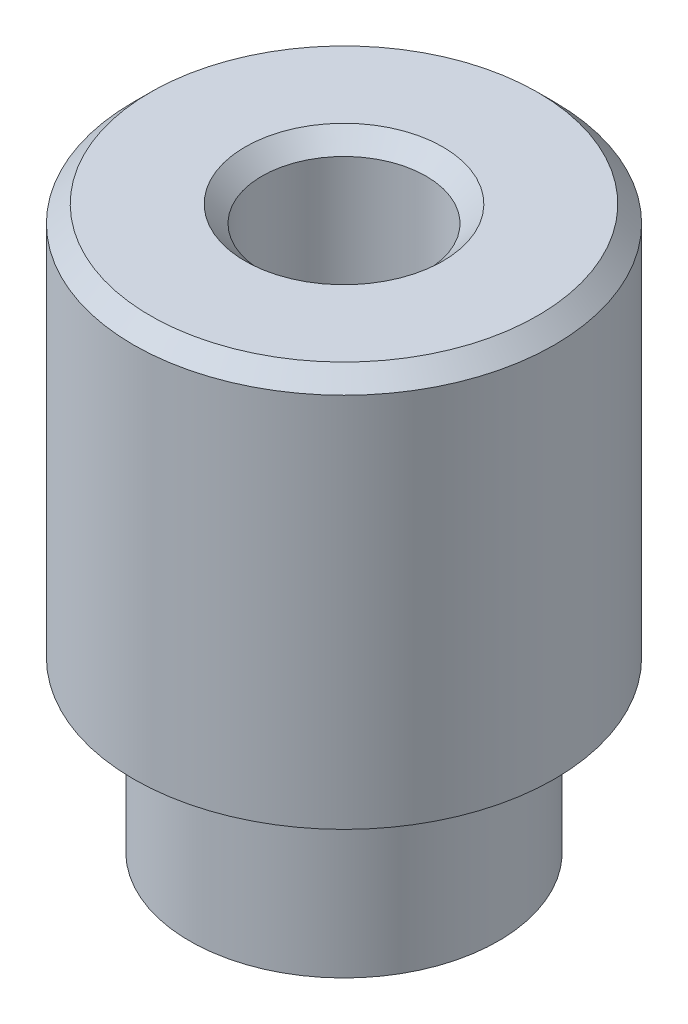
SolidWorks part; units mm, degrees
ref_plane "Plan de face" through (0, 0, 0) normal (0, 0, 1) x (1, 0, 0)
ref_plane "Plan de dessus" through (0, 0, 0) normal (0, 1, 0) x (1, 0, 0)
ref_plane "Plan de droite" through (0, 0, 0) normal (1, 0, 0) x (0, 0, -1)
sketch "Esquisse2" plane through (0, 0, 0) normal (0, 0, 1) x (1, 0, 0)
  line L0 (0, 0) -> (0, 22.7557) construction
  line L1 (-7.5, 20) -> (-2.925, 20)
  line L2 (-2.925, 20) -> (-2.925, 9.5)
  line L3 (-1.425, 8) -> (0, 8)
  line L4 (0, 8) -> (0, 0)
  line L5 (0, 0) -> (-5.5, 0)
  line L6 (-7.5, 6) -> (-7.5, 20)
  line L7 (-5.5, 0) -> (-5.5, 5.4)
  line L8 (-6.1, 6) -> (-7.5, 6)
  arc A0 (-2.925, 9.5) -> (-1.425, 8) centre (-1.425, 9.5) ccw
  arc A1 (-6.1, 6) -> (-5.5, 5.4) centre (-6.1, 5.4) cw
  point P14 (-5.5, 6)
  dimension "D5" = 1.5
  dimension "D8" = 0.6
  dimension "D1" = 15
  dimension "D2" = 5.85
  dimension "D3" = 8
  dimension "D4" = 20
  dimension "D6" = 11
  dimension "D7" = 6
revolve "Révolution1" add sketch "Esquisse2" angle 360 about L0
sketch "Esquisse3" plane through (0, 0, 0) normal (0, -1, 0) x (1, 0, 0)
  line L0 (0, -2.5) -> (0, 2.5) construction
  line L1 (-1.6, -2.0494) -> (-1.6, 2.0494)
  line L2 (1.6, -2.0494) -> (1.6, 2.0494)
  arc A0 (1.6, 2.0494) -> (-1.6, 2.0494) centre (0, 0) ccw
  arc A2 (-1.6, -2.0494) -> (1.6, -2.0494) centre (0, 0) ccw
  point P2 (0, 0)
  dimension "D3" = 5.2
  dimension "D1" = 3.2
  dimension "D2" = 5
extrude "Enlèv. mat.-Extru.1" cut sketch "Esquisse3" against normal blind 8
chamfer "Chanfrein1" distance 0.6 angle 45 2 edges at (0, 20, -7.5) (0, 20, -2.925)
